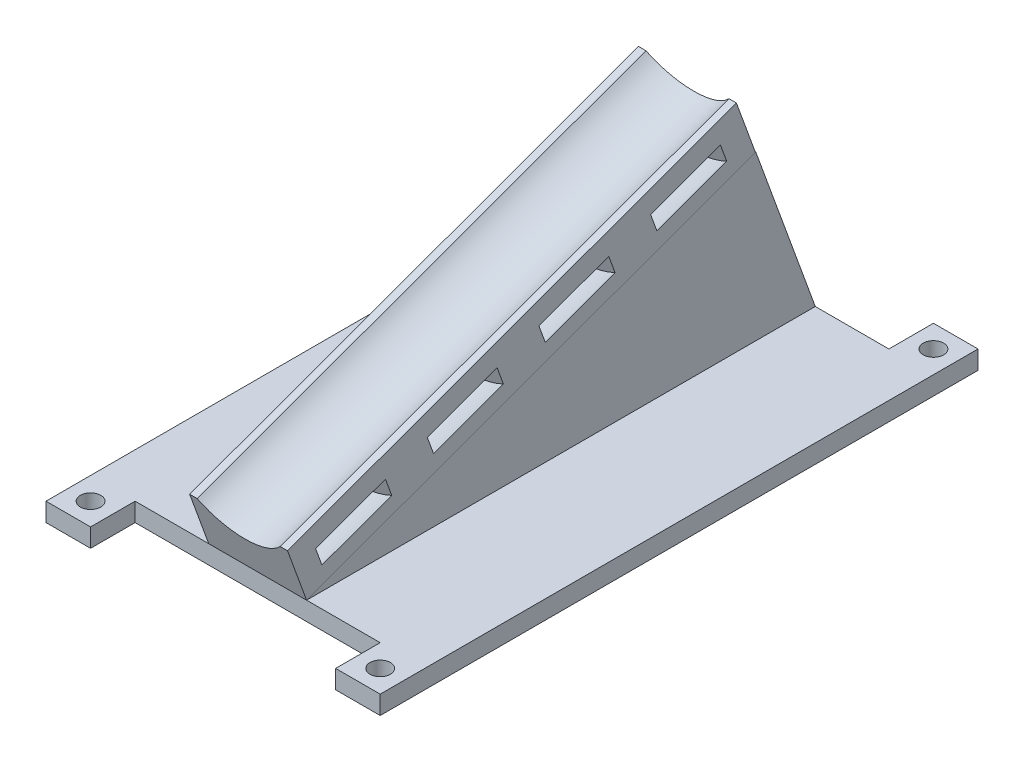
SolidWorks part; units mm, degrees
ref_plane "Front Plane" through (0, 0, 0) normal (0, 0, 1) x (1, 0, 0)
ref_plane "Top Plane" through (0, 0, 0) normal (0, 1, 0) x (1, 0, 0)
ref_plane "Right Plane" through (0, 0, 0) normal (1, 0, 0) x (0, 0, -1)
sketch "Sketch2" plane through (0, 0, 0) normal (0, 1, 0) x (1, 0, 0)
  line L0 (0, 0) -> (12, 0)
  line L1 (12, 0) -> (12, 12)
  line L2 (12, 12) -> (78, 12)
  line L3 (78, 12) -> (78, 0)
  line L4 (78, 0) -> (90, 0)
  line L5 (90, 0) -> (90, 161)
  line L6 (90, 161) -> (78, 161)
  line L7 (78, 161) -> (78, 149)
  line L8 (78, 149) -> (12, 149)
  line L9 (12, 149) -> (12, 161)
  line L10 (12, 161) -> (0, 161)
  line L11 (0, 161) -> (0, 0)
  circle A0 centre (6, 155) radius 2.75
  circle A1 centre (84, 155) radius 2.75
  circle A2 centre (84, 6) radius 2.75
  circle A3 centre (6, 6) radius 2.75
  dimension "D7" = 5.5
  dimension "D1" = 90
  dimension "D2" = 12
  dimension "D3" = 12
  dimension "D4" = 12
  dimension "D5" = 12
  dimension "D6" = 161
  dimension "D10" = 6
  dimension "D11" = 6
  dimension "D12" = 12
  dimension "D13" = 12
  dimension "D14" = 12
  dimension "D8" = 2
  dimension "D9" = 2
extrude "Boss-Extrude1" add sketch "Sketch2" along normal blind 5
sketch "Sketch14" plane through (12, 0, 0) normal (1, 0, 0) x (0, 0, -1)
  line L0 (12, 5) -> (3.6599, 27.9143)
  line L1 (0, 5) -> (161, 5) construction
  dimension "D1" = 70
ref_plane "Plane4" through (0, 4.4416, -12.2032) normal (0, -0.342, 0.9397) x (1, 0, 0)
sketch "Sketch15" plane through (0, 4.4416, -12.2032) normal (0, -0.342, 0.9397) x (1, 0, 0)
  line L0 (31.8197, 0.5942) -> (58.1803, 0.5942)
  line L1 (12, 0.5942) -> (78, 0.5942) construction
  line L2 (58.1803, 0.5942) -> (58.1803, 15.5942)
  line L3 (58.1803, 15.5942) -> (56.1803, 15.5942)
  line L4 (33.8197, 15.5942) -> (31.8197, 15.5942)
  line L5 (31.8197, 15.5942) -> (31.8197, 0.5942)
  line L6 (90, 0) -> (90, -55.0652) construction
  arc A0 (33.8197, 15.5942) -> (56.1803, 15.5942) centre (45, 25.5942) ccw
  point P5 (45, 0.5942)
  point P8 (32.8197, 15.5942)
  dimension "D3" = 15
  dimension "D1" = 15
  dimension "D2" = 25
  dimension "D4" = 180
  dimension "D5" = 2
  dimension "D6" = 2
  dimension "D7" = 45
extrude "Boss-Extrude2" add sketch "Sketch15" against normal blind 128.64 separate body
sketch "Sketch17" plane through (58.1803, 0, 0) normal (1, 0, 0) x (0, 0, -1)
  line L0 (12, 5) -> (149, 5)
  line L1 (149, 5) -> (132.974, 49.031)
  line L2 (132.974, 49.031) -> (12, 5)
  line L3 (132.8821, 48.9975) -> (12, 5) construction
  dimension "D1" = 137
  dimension "D2" = 90
extrude "Boss-Extrude3" add sketch "Sketch17" against normal up to surface (26.3607 mm away)
ref_axis "Axis1" through (45, 67.3431, -110.191) along (0, -0.342, 0.9397)
ref_plane "Plane6" through (45, 0, 0) normal (1, 0, 0) x (0, 0, -1)
sketch "Sketch18" plane through (45, 0, 0) normal (1, 0, 0) x (0, 0, -1)
  line L0 (17.4475, 7.5148) -> (36.2414, 14.3552)
  line L2 (36.2414, 14.3552) -> (34.8733, 18.114)
  line L3 (34.8733, 18.114) -> (16.0795, 11.2736)
  line L4 (16.0795, 11.2736) -> (17.4475, 7.5148)
  line L5 (132.974, 49.031) -> (12, 5) construction
  dimension "D1" = 4
  dimension "D2" = 20
  dimension "D3" = 6
  dimension "D4" = 0.5
revolve "Cut-Revolve1" cut sketch "Sketch18" angle 360 about axis through (45, 67.3431, -110.191) along (0, -0.342, 0.9397)
pattern_linear "LPattern1" count 4 spacing 32 along (0, 0.342, -0.9397) of "Cut-Revolve1"
